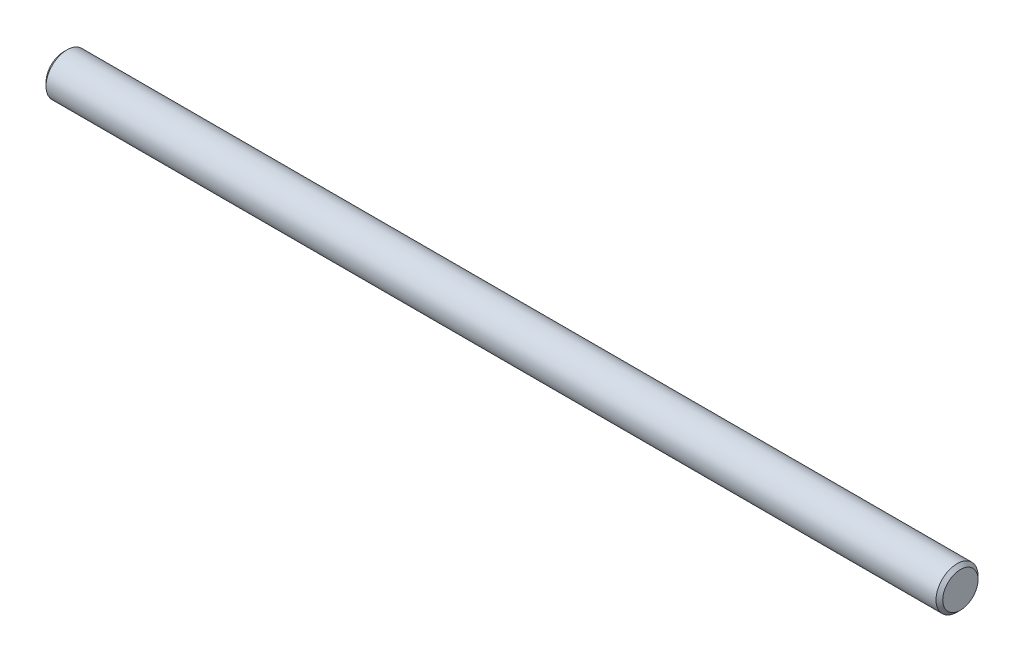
SolidWorks part; units mm, degrees
ref_plane "Front" through (0, 0, 0) normal (0, 0, 1) x (1, 0, 0)
ref_plane "Top" through (0, 0, 0) normal (0, 1, 0) x (1, 0, 0)
ref_plane "Right" through (0, 0, 0) normal (1, 0, 0) x (0, 0, -1)
sketch "Sketch1" plane through (0, 0, 0) normal (1, 0, 0) x (0, 0, -1)
  circle A0 centre (0, 0) radius 2.3812
  dimension "D1" = 4.7625
extrude "Extrude1" add sketch "Sketch1" along normal blind 101.6
chamfer "Chamfer1" distance 0.381 angle 45 2 edges at (0, 0, -2.3812) (101.6, 0, -2.3812)
